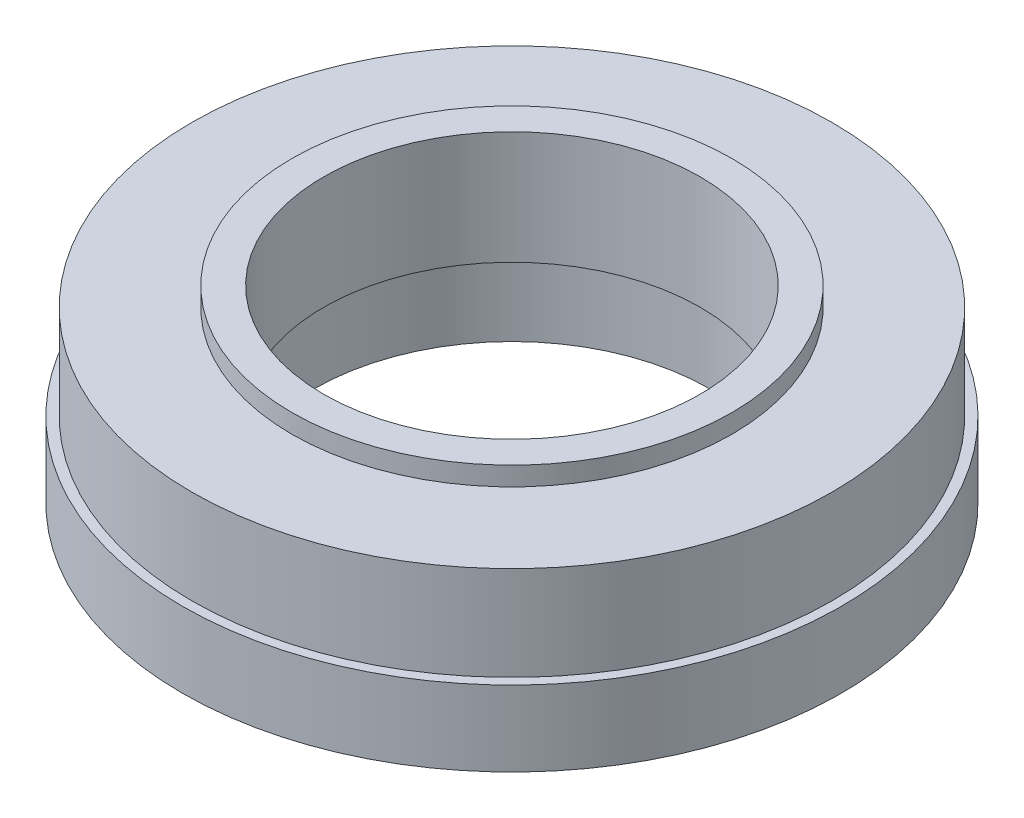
SolidWorks part; units mm, degrees
ref_plane "Front Plane" through (0, 0, 0) normal (0, 0, 1) x (1, 0, 0)
ref_plane "Top Plane" through (0, 0, 0) normal (0, 1, 0) x (1, 0, 0)
ref_plane "Right Plane" through (0, 0, 0) normal (1, 0, 0) x (0, 0, -1)
sketch "Sketch1" plane through (0, 0, 0) normal (0, 1, 0) x (1, 0, 0)
  circle A0 centre (0, 0) radius 17.5
  circle A1 centre (0, 0) radius 10.5
  dimension "D1" = 35
  dimension "D2" = 21
extrude "Extrude1" add sketch "Sketch1" along normal blind 4
sketch "Sketch3" plane through (0, 4, 0) normal (0, 1, 0) x (-1, 0, 0)
  circle A0 centre (0, 0) radius 10
  circle A1 centre (0, 0) radius 17
  dimension "D1" = 34
  dimension "D2" = 20
extrude "Extrude2" add sketch "Sketch3" along normal blind 2
sketch "Sketch4" plane through (0, 6, 0) normal (0, 1, 0) x (-1, 0, 0)
  circle A0 centre (0, 0) radius 10
  circle A1 centre (0, 0) radius 17
  dimension "D1" = 34
  dimension "D2" = 20
extrude "Extrude3" add sketch "Sketch4" along normal blind 3
sketch "Sketch5" plane through (0, 9, 0) normal (0, 1, 0) x (-1, 0, 0)
  circle A0 centre (0, 0) radius 10
  circle A1 centre (0, 0) radius 11.684
  dimension "D1" = 23.368
extrude "Extrude4" add sketch "Sketch5" along normal blind 1
